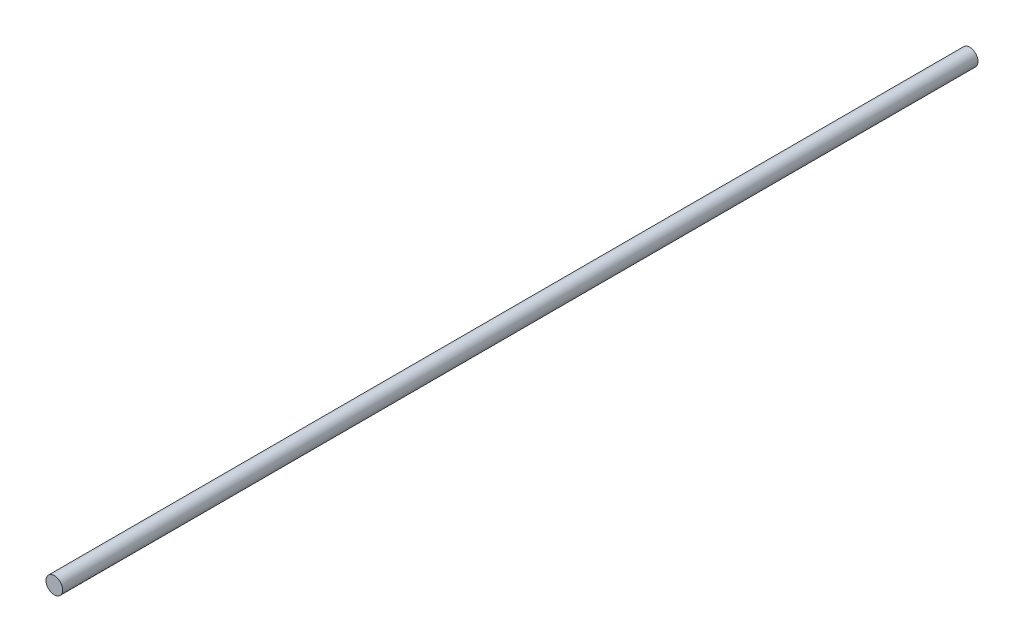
SolidWorks part; units mm, degrees
ref_plane "Front Plane" through (0, 0, 0) normal (0, 0, 1) x (1, 0, 0)
ref_plane "Top Plane" through (0, 0, 0) normal (0, 1, 0) x (1, 0, 0)
ref_plane "Right Plane" through (0, 0, 0) normal (1, 0, 0) x (0, 0, -1)
sketch "Sketch1" plane through (0, 0, 0) normal (0, 0, 1) x (1, 0, 0)
  circle A0 centre (0, 0) radius 30
  dimension "D1" = 60
extrude "Boss-Extrude1" add sketch "Sketch1" against normal blind 3300
